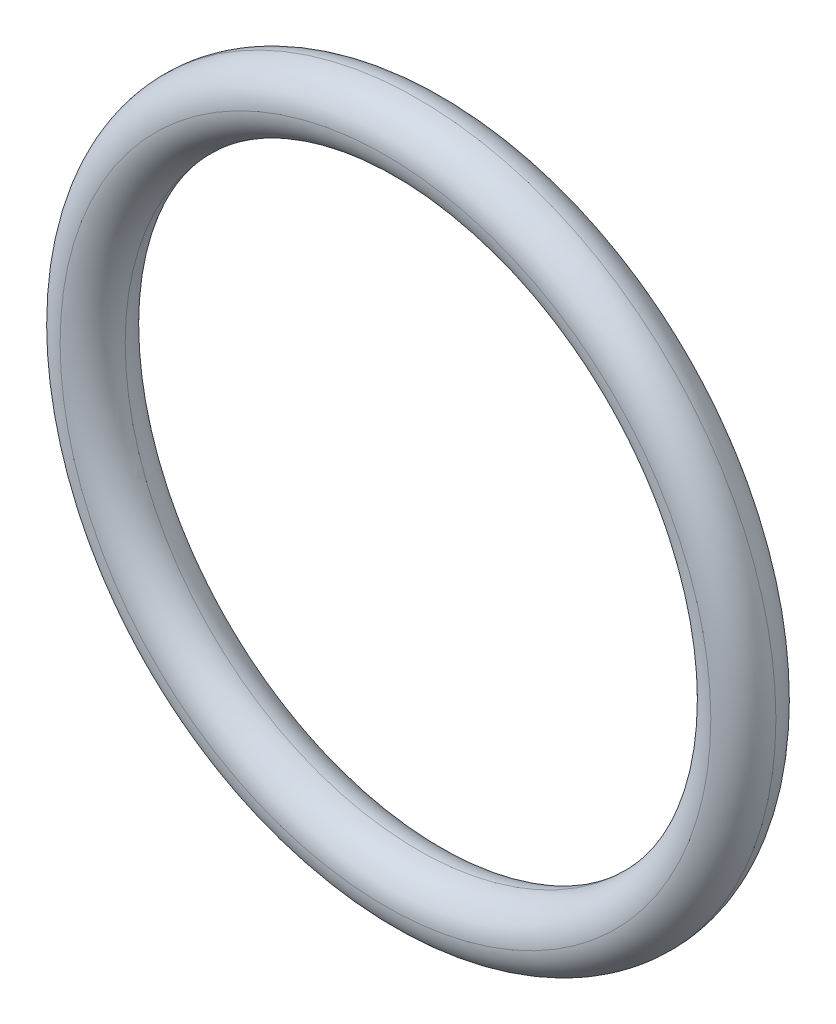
SolidWorks part; units mm, degrees
ref_plane "Plan de face" through (0, 0, 0) normal (0, 0, 1) x (1, 0, 0)
ref_plane "Plan de dessus" through (0, 0, 0) normal (0, 1, 0) x (1, 0, 0)
ref_plane "Plan de droite" through (0, 0, 0) normal (1, 0, 0) x (0, 0, -1)
sketch "Esquisse1" plane through (0, 0, 0) normal (0, 0, 1) x (1, 0, 0)
  line L0 (0, -57.8556) -> (0, 81.8444) construction
  line L1 (-65.3815, 0) -> (112.6537, 0) construction
  circle A0 centre (0, 0) radius 36
  circle A1 centre (0, 0) radius 44
extrude "Extrusion1" add sketch "Esquisse1" along normal blind 8
fillet "Congé1" radius 4 4 edges at (36, 0, 0) (44, 0, 0) (36, 0, 8) (44, 0, 8)
